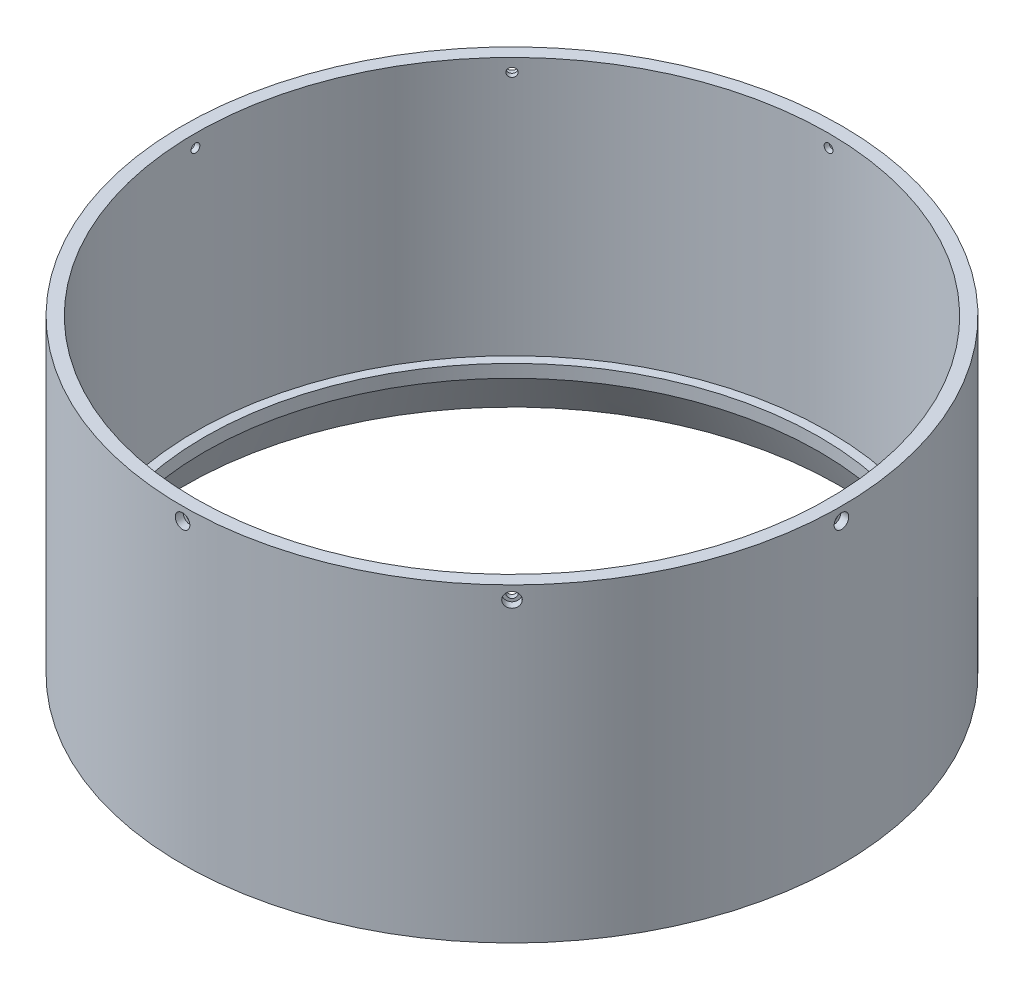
SolidWorks part; units mm, degrees
ref_plane "Front Plane" through (0, 0, 0) normal (0, 0, 1) x (1, 0, 0)
ref_plane "Top Plane" through (0, 0, 0) normal (0, 1, 0) x (1, 0, 0)
ref_plane "Right Plane" through (0, 0, 0) normal (1, 0, 0) x (0, 0, -1)
sketch "Sketch1" plane through (0, 0, 0) normal (0, 0, 1) x (1, 0, 0)
  line L0 (0, 0) -> (0, 162.199) construction
  line L1 (-155.575, 152.4) -> (-155.575, 25.4433)
  line L2 (-161.925, 0) -> (-160.655, 0)
  line L3 (-161.925, 0) -> (-161.925, 152.4)
  line L4 (-161.925, 152.4) -> (-155.575, 152.4)
  line L5 (-151.003, 19.0933) -> (-151.003, 25.4433)
  line L6 (-155.575, 25.4433) -> (-151.003, 25.4433)
  line L7 (-151.003, 19.0933) -> (-160.655, 0)
  dimension "D1" = 323.85
  dimension "D2" = 302.006
  dimension "D3" = 152.4
  dimension "D4" = 1.27
  dimension "D5" = 6.35
  dimension "D6" = 6.35
  dimension "D7" = 25.4433
revolve "Revolve1" add sketch "Sketch1" angle 360 about L0
ref_plane "Plane1" through (0, 0, -161.925) normal (0, 0, -1) x (-1, 0, 0)
hole_wizard "CBORE for #6 Socket Head Cap Screw1" positions "Sketch3" profile "Sketch4" counterbore size "#6" standard "ANSI Inch"
sketch "Sketch3" plane through (0, 0, -161.925) normal (0, 0, -1) x (-1, 0, 0)
  line L0 (0, 0) -> (0, 162.199) construction
  line L1 (161.925, 152.4) -> (-161.925, 152.4) construction
  point P0 (0, 146.05)
  dimension "D1" = 6.35
sketch "Sketch4" plane through (0, 146.05, -161.925) normal (1, 0, 0) x (0, 1, 0)
  line L0 (0, 0) -> (0, 390.9215)
  line L1 (0, 390.9215) -> (2.1526, 390.9215)
  line L3 (2.1526, 390.9215) -> (2.1527, 3.8862)
  line L4 (2.1527, 3.8862) -> (3.5725, 3.8862)
  line L5 (3.5725, 3.8862) -> (3.5725, 0)
  line L7 (3.5725, 0) -> (0, 0)
  line L11 (0, -6.35) -> (0, 107.95) construction
  dimension "Thru Hole Dia." = 4.3053
  dimension "Thru Hole Depth" = 390.9215
  dimension "C'Bore Dia." = 7.145
  dimension "C'Bore Depth" = 3.8862
pattern_circular "CirPattern1" count 8 over 360 about axis through (0, 0, 0) along (0, 1, 0) of "CBORE for #6 Socket Head Cap Screw1"
